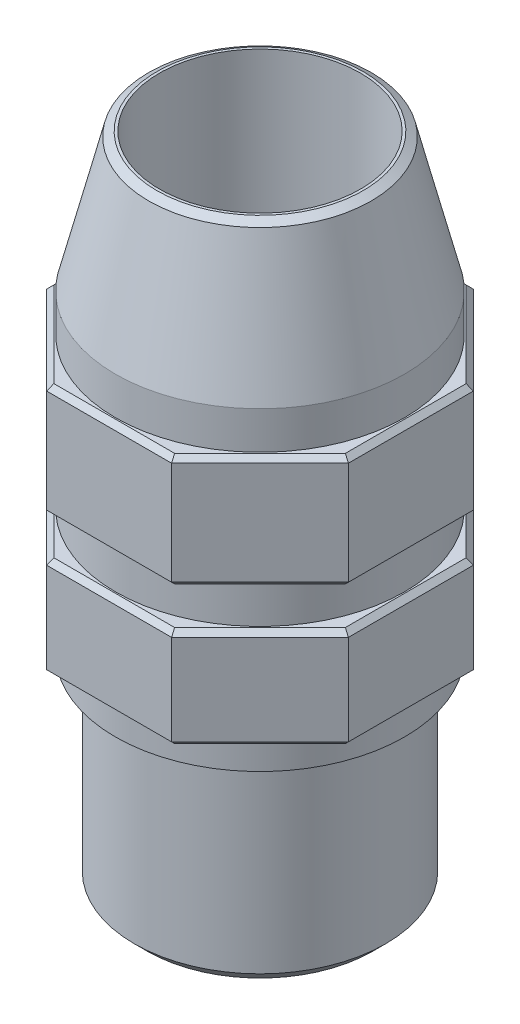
SolidWorks part; units mm, degrees
ref_plane "Face" through (0, 0, 0) normal (0, 0, 1) x (1, 0, 0)
ref_plane "Dessus" through (0, 0, 0) normal (0, 1, 0) x (1, 0, 0)
ref_plane "Droite" through (0, 0, 0) normal (1, 0, 0) x (0, 0, -1)
sketch "Esquisse1" plane through (0, 0, 0) normal (0, 1, 0) x (1, 0, 0)
  line L0 (-6, 0) -> (6, 0) construction
  line L15 (-2.4853, 6) -> (2.4853, 6)
  line L16 (-6, 2.4853) -> (-6, -2.4853)
  line L17 (-2.4853, -6) -> (2.4853, -6)
  line L18 (6, 2.4853) -> (6, -2.4853)
  line L20 (-2.4853, 6) -> (-6, 2.4853)
  line L21 (-6, -2.4853) -> (-2.4853, -6)
  line L22 (2.4853, -6) -> (6, -2.4853)
  line L23 (2.4853, 6) -> (6, 2.4853)
  circle A5 centre (0, 0) radius 6 construction
  dimension "D1" = 12
extrude "Boss.-Extru.1" add sketch "Esquisse1" along normal blind 10
sketch "Esquisse2" plane through (0, 10, 0) normal (0, 1, 0) x (1, 0, 0)
  circle A0 centre (0, 0) radius 5.75
  dimension "D1" = 11.5
extrude "Boss.-Extru.2" add sketch "Esquisse2" along normal blind 1.5
sketch "Esquisse3" plane through (0, 11.5, 0) normal (0, 1, 0) x (1, 0, 0)
  circle A0 centre (0, 0) radius 5.75
extrude "Boss.-Extru.3" add sketch "Esquisse3" along normal blind 5.5 draft 14
sketch "Esquisse4" plane through (0, 0, 0) normal (0, -1, 0) x (-1, 0, 0)
  circle A0 centre (0, 0) radius 5.75
  dimension "D1" = 11.5
extrude "Boss.-Extru.4" add sketch "Esquisse4" along normal blind 1
sketch "Esquisse5" plane through (0, -1, 0) normal (0, -1, 0) x (1, 0, 0)
  circle A0 centre (0, 0) radius 5
  dimension "D1" = 10
extrude "Boss.-Extru.5" add sketch "Esquisse5" along normal blind 8
sketch "Esquisse6" plane through (0, -9, 0) normal (0, -1, 0) x (1, 0, 0)
  circle A0 centre (0, 0) radius 4
  dimension "D1" = 8
extrude "Enlèv. mat.-Extru.1" cut sketch "Esquisse6" against normal through all
chamfer "Chanfrein1" distance 0.5 angle 45 2 edges at (0, -9, -4) (0, -9, -5)
ref_plane "Plan1" through (0, 4, 0) normal (0, -1, 0) x (-1, 0, 0)
sketch "Esquisse7" plane through (0, 4, 0) normal (0, -1, 0) x (-1, 0, 0)
  circle A0 centre (0, 0) radius 5.75
  dimension "D1" = 11.5
extrude "Enlèv. mat.-Extru.2" cut sketch "Esquisse7" against normal blind 1.5 flip side to cut
chamfer "Chanfrein3" distance 0.2 angle 45 33 edges at (0, 10, 6) (-4.2426, 10, 4.2426) (-6, 10, 0) (-4.2426, 10, -4.2426) (0, 10, -6) (4.2426, 10, -4.2426) (4.2426, 10, 4.2426) (6, 10, 0) (6, 5.5, 0) (-4.2426, 4, -4.2426) (-4.2426, 5.5, -4.2426) (0, 5.5, -6) (4.2426, 5.5, -4.2426) (4.2426, 5.5, 4.2426) (0, 5.5, 6) (-4.2426, 5.5, 4.2426) (-6, 5.5, 0) (4.2426, 0, -4.2426) (0, 0, -6) (-4.2426, 0, -4.2426) (-6, 0, 0) (-6, 4, 0) (4.2426, 4, -4.2426) (0, 4, -6) (4.2426, 0, 4.2426) (0, 0, 6) (-4.2426, 0, 4.2426) (4.2426, 4, 4.2426) (0, 4, 6) (-4.2426, 4, 4.2426) (6, 0, 0) (6, 4, 0) (0, 17, 4.3787)
